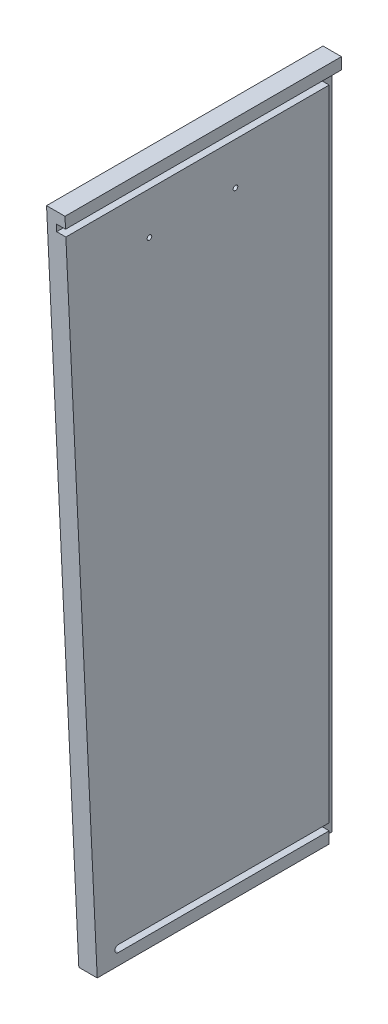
SolidWorks part; units mm, degrees
ref_plane "Front Plane" through (0, 0, 0) normal (0, 0, 1) x (1, 0, 0)
ref_plane "Top Plane" through (0, 0, 0) normal (0, 1, 0) x (1, 0, 0)
ref_plane "Right Plane" through (0, 0, 0) normal (1, 0, 0) x (0, 0, -1)
sketch "Sketch1" plane through (0, 0, 0) normal (1, 0, 0) x (0, 0, -1)
  line L0 (0, 0) -> (0, -698.5)
  line L1 (0, 0) -> (-285.75, 0)
  line L2 (0, -698.5) -> (-252.4125, -698.5)
  line L3 (-285.75, 0) -> (-252.4125, -698.5)
  dimension "D1" = 285.75
  dimension "D2" = 698.5
  dimension "D3" = 252.4125
extrude "Boss-Extrude1" add sketch "Sketch1" along normal blind 19.05
sketch "Sketch2" plane through (0, 0, 0) normal (0, 0, -1) x (-1, 0, 0)
  line L0 (-19.05, -698.5) -> (-19.05, 0) construction
  line L1 (-19.05, -11.9063) -> (-9.525, -11.9062)
  line L2 (-19.05, -11.9063) -> (-19.05, -19.05)
  line L3 (-19.05, -19.05) -> (-9.525, -19.05)
  line L4 (-9.525, -11.9062) -> (-9.525, -19.05)
  line L5 (-19.05, 0) -> (0, 0) construction
  dimension "D1" = 11.9062
  dimension "D2" = 7.1437
  dimension "D3" = 9.525
extrude "Cut-Extrude1" cut sketch "Sketch2" against normal through all
sketch "Sketch3" plane through (19.05, 0, 0) normal (1, 0, 0) x (0, 0, -1)
  line L0 (0, -698.5) -> (0, -19.05) construction
  line L1 (0, -679.45) -> (-230.5399, -679.45)
  line L2 (0, -679.45) -> (0, -686.5938)
  line L3 (0, -686.5938) -> (-230.5399, -686.5938)
  line L4 (-230.5399, -679.45) -> (-230.5399, -686.5938) construction
  line L5 (-252.4125, -698.5) -> (0, -698.5) construction
  arc A0 (-230.5399, -679.45) -> (-230.5399, -686.5938) centre (-230.5399, -683.0219) ccw
  dimension "D1" = 234.1118
  dimension "D2" = 7.1437
  dimension "D3" = 11.9062
extrude "Cut-Extrude2" cut sketch "Sketch3" against normal blind 9.525
sketch "Sketch4" plane through (0, 0, 0) normal (-1, 0, 0) x (0, 0, 1)
  line L0 (109.5375, -62.7062) -> (198.4375, -62.7063) construction
  line L1 (0, 0) -> (285.75, 0) construction
  line L2 (0, -698.5) -> (0, 0) construction
  circle A0 centre (198.4375, -62.7063) radius 2.3813
  circle A1 centre (109.5375, -62.7062) radius 2.3813
  dimension "D1" = 4.7625
  dimension "D4" = 109.5375
  dimension "D2" = 88.9
  dimension "D3" = 62.7063
extrude "Cut-Extrude3" cut sketch "Sketch4" against normal through all
sketch "Sketch5" plane through (0, 0, 0) normal (0, 0, -1) x (-1, 0, 0)
  line L0 (-19.05, -698.5) -> (0, -698.5) construction
  line L1 (-9.525, -11.9062) -> (-60.325, -11.9063)
  line L2 (-9.525, -11.9062) -> (-9.525, -698.5)
  line L3 (-9.525, -698.5) -> (-60.325, -698.5)
  line L4 (-60.325, -11.9063) -> (-60.325, -698.5)
  dimension "D1" = 50.8
extrude "Cut-Extrude4" cut sketch "Sketch5" against normal blind 12.7
